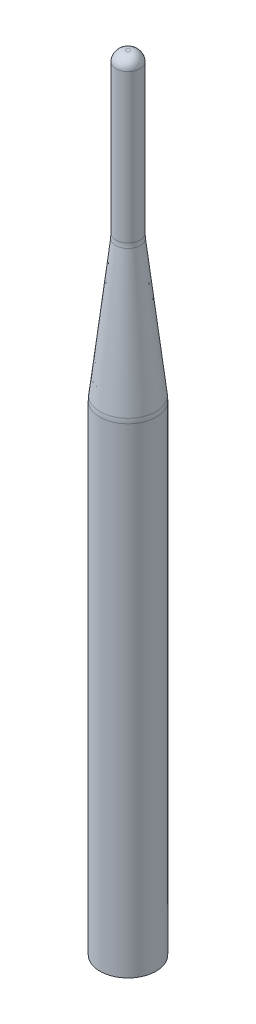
SolidWorks part; units mm, degrees
ref_plane "Front Plane" through (0, 0, 0) normal (0, 0, 1) x (1, 0, 0)
ref_plane "Top Plane" through (0, 0, 0) normal (0, 1, 0) x (1, 0, 0)
ref_plane "Right Plane" through (0, 0, 0) normal (1, 0, 0) x (0, 0, -1)
sketch "Sketch2" plane through (0, 0, 0) normal (0, 0, 1) x (1, 0, 0)
  line L0 (3, 192.5) -> (3, 155.5696)
  line L1 (0, 0) -> (7, 0)
  line L2 (0, 0) -> (0, 195)
  line L3 (0, 195) -> (0.5, 195)
  line L4 (7, 0) -> (7, 119.4304)
  line L5 (3.0647, 154.4341) -> (6.9353, 120.5659)
  arc A0 (3, 192.5) -> (0.5, 195) centre (0.5, 192.5) ccw
  arc A1 (3, 155.5696) -> (3.0647, 154.4341) centre (13, 155.5696) ccw
  arc A2 (6.9353, 120.5659) -> (7, 119.4304) centre (-3, 119.4304) cw
  point P9 (3, 195)
  point P12 (3, 155)
  point P15 (7, 120)
  dimension "D6" = 2.5
  dimension "D7" = 10
  dimension "D1" = 7
  dimension "D2" = 195
  dimension "D3" = 3
  dimension "D4" = 120
  dimension "D5" = 40
revolve "Antenna" add sketch "Sketch2" angle 360 about L2
